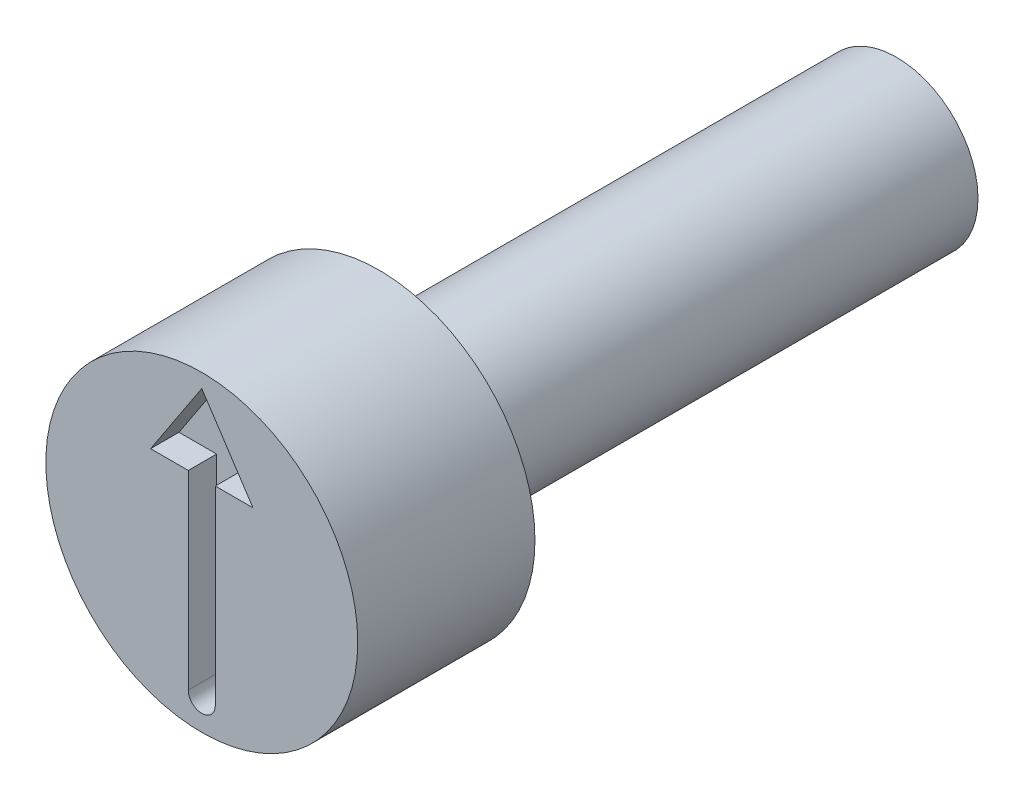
SolidWorks part; units mm, degrees
ref_plane "Front Plane" through (0, 0, 0) normal (0, 0, 1) x (1, 0, 0)
ref_plane "Top Plane" through (0, 0, 0) normal (0, 1, 0) x (1, 0, 0)
ref_plane "Right Plane" through (0, 0, 0) normal (1, 0, 0) x (0, 0, -1)
sketch "Sketch2" plane through (0, 0, 0) normal (1, 0, 0) x (0, 0, -1)
  line L0 (0.4039, 0) -> (50000.4039, 0) construction
  line L6 (0, 2.2) -> (0, 0)
  line L7 (2.5, 2.2) -> (0, 2.2)
  line L8 (2.5, 1.15) -> (2.5, 2.2)
  line L9 (9.8, 1.15) -> (2.5, 1.15)
  line L10 (9.8, 0) -> (9.8, 1.15)
  line L11 (0, 0) -> (9.8, 0)
  dimension "D1" = 4.4
  dimension "D2" = 2.3
  dimension "D3" = 9.8
  dimension "D4" = 2.5
revolve "Revolve1" add sketch "Sketch2" angle 360 about L0
sketch "Sketch3" plane through (0, 0, 0) normal (0, 0, 1) x (1, 0, 0)
  line L0 (0, 0) -> (0, 100000) construction
  line L1 (0.1905, 0.9064) -> (0.1905, -1.7762)
  line L2 (0.7219, 0.9064) -> (0.1905, 0.9064)
  line L3 (0, 2.0021) -> (0.7219, 0.9064)
  line L15 (0, 2.0021) -> (-0.7219, 0.9064)
  line L16 (-0.7219, 0.9064) -> (-0.1905, 0.9064)
  line L17 (-0.1905, 0.9064) -> (-0.1905, -1.7762)
  arc A2 (-0.1905, -1.7762) -> (0.1905, -1.7762) centre (0, -1.7762) ccw
extrude "Cut-Extrude4" cut sketch "Sketch3" against normal blind 0.4
